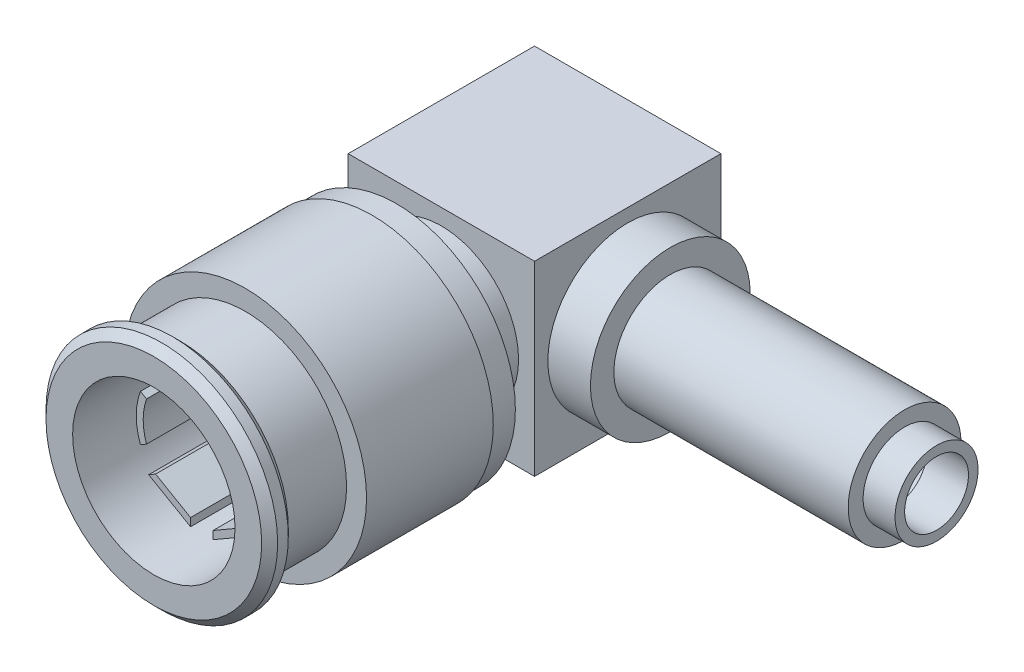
SolidWorks part; units mm, degrees
ref_plane "Front Plane" through (0, 0, 0) normal (0, 0, 1) x (1, 0, 0)
ref_plane "Top Plane" through (0, 0, 0) normal (0, 1, 0) x (1, 0, 0)
ref_plane "Right Plane" through (0, 0, 0) normal (1, 0, 0) x (0, 0, -1)
imported_body "Imported3"
sketch "Sketch1" plane through (0, 3.6802, 0) normal (0, 1, 0) x (-1, 0, 0)
  line L0 (-3.6716, -13.716) -> (3.683, -13.716)
  line L1 (3.683, -13.716) -> (3.683, -22.606)
  line L2 (3.683, -22.606) -> (-3.6716, -22.606)
  line L3 (-3.6716, -22.606) -> (-3.6716, -13.716)
extrude "Boss-Extrude1" add sketch "Sketch1" along normal blind 0.7648
sketch "Sketch2" plane through (3.6716, 0, 0) normal (1, 0, 0) x (0, 0, -1)
  line L0 (13.716, -3.683) -> (13.716, 4.445)
  line L1 (13.716, 4.445) -> (22.606, 4.445)
  line L2 (22.606, 4.445) -> (22.606, -3.683)
  line L3 (22.606, -3.683) -> (13.716, -3.683)
extrude "Boss-Extrude2" add sketch "Sketch2" along normal blind 0.7734
sketch "Sketch3" plane through (0, -3.683, 0) normal (0, -1, 0) x (1, 0, 0)
  line L0 (-3.683, -13.716) -> (4.445, -13.716)
  line L1 (4.445, -13.716) -> (4.445, -22.606)
  line L2 (4.445, -22.606) -> (-3.683, -22.606)
  line L3 (-3.683, -22.606) -> (-3.683, -13.716)
extrude "Boss-Extrude3" add sketch "Sketch3" along normal blind 0.762
sketch "Sketch4" plane through (-3.683, 0, 0) normal (-1, 0, 0) x (0, 0, 1)
  line L0 (-22.606, 4.445) -> (-13.716, 4.445)
  line L1 (-13.716, 4.445) -> (-13.716, -4.445)
  line L2 (-13.716, -4.445) -> (-22.606, -4.445)
  line L3 (-22.606, -4.445) -> (-22.606, 4.445)
extrude "Boss-Extrude4" add sketch "Sketch4" along normal blind 0.762
hole_wizard "M7 Clearance Hole1" positions "Sketch6" profile "Sketch5" hole size "M7" standard "ANSI Metric"
sketch "Sketch6" plane through (0, 0, 0) normal (0, 0, 1) x (1, 0, 0)
  point P0 (0, 0)
sketch "Sketch5" plane through (0, 0, 0) normal (1, 0, 0) x (0, -1, 0)
  line L0 (0, 0) -> (0, 6.1722)
  line L1 (0, 6.1722) -> (3.8735, 6.1722)
  line L2 (3.8735, 6.1722) -> (3.8735, 0)
  line L5 (3.8735, 0) -> (0, 0)
  line L10 (0, 6.1722) -> (-3.8735, 6.1722) construction
  line L11 (0, -6.35) -> (0, 107.95) construction
  dimension "Hole Dia." = 7.747
  dimension "Hole Depth" = 6.1722
  dimension "Drill Angle" = 180
sketch "Sketch7" plane through (0, 0, -6.1722) normal (0, 0, 1) x (1, 0, 0)
  line L0 (2.9236, -1.1014) -> (2.6333, -0.9338)
  line L1 (2.6333, 0.9338) -> (2.9236, 1.1014)
  arc A0 (2.6333, -0.9338) -> (2.6333, 0.9338) centre (0, 0) ccw
  arc A1 (2.9236, 1.1014) -> (2.9236, -1.1014) centre (0, 0) cw
extrude "Boss-Extrude5" add sketch "Sketch7" along normal blind 3.8862
sketch "Sketch8" plane through (0, 0, -6.1722) normal (0, 0, 1) x (1, 0, 0)
  line L0 (-2.6333, -0.9338) -> (-2.9236, -1.1014)
  line L1 (-2.9236, 1.1014) -> (-2.6333, 0.9338)
  arc A0 (-2.9236, -1.1014) -> (-2.9236, 1.1014) centre (0, 0) cw
  arc A1 (-2.6333, 0.9338) -> (-2.6333, -0.9338) centre (0, 0) ccw
extrude "Boss-Extrude6" add sketch "Sketch8" along normal blind 3.8862
sketch "Sketch9" plane through (0, 0, -6.1722) normal (0, 0, 1) x (1, 0, 0)
  line L0 (2.6333, 0.9338) -> (2.9236, 1.1014)
  line L1 (-2.9236, 1.1014) -> (-2.6333, 0.9338)
  line L2 (-2.6333, -0.9338) -> (-2.9236, -1.1014)
  line L3 (2.9236, -1.1014) -> (2.6333, -0.9338)
  arc A0 (2.6333, -0.9338) -> (2.6333, 0.9338) centre (0, 0) ccw
  arc A1 (2.9236, 1.1014) -> (-2.9236, 1.1014) centre (0, 0) ccw
  arc A2 (-2.6333, 0.9338) -> (-2.6333, -0.9338) centre (0, 0) ccw
  arc A3 (-2.9236, -1.1014) -> (2.9236, -1.1014) centre (0, 0) ccw
extrude "Cut-Extrude1" cut sketch "Sketch9" against normal blind 0.9398
sketch "Sketch10" plane through (0, 0, -7.112) normal (0, 0, 1) x (1, 0, 0)
  line L0 (2.9236, -1.1014) -> (2.6333, -0.9338)
  line L1 (-2.6333, -0.9338) -> (-2.9236, -1.1014)
  arc A0 (-2.9236, -1.1014) -> (2.9236, -1.1014) centre (0, 0) ccw
  arc A1 (2.6333, -0.9338) -> (-2.6333, -0.9338) centre (0, 0) cw
extrude "Cut-Extrude2" cut sketch "Sketch10" against normal blind 0.254
sketch "Sketch11" plane through (0, 0, -7.112) normal (0, 0, 1) x (1, 0, 0)
  line L0 (-2.9236, 1.1014) -> (-2.6333, 0.9338)
  line L1 (2.6333, 0.9338) -> (2.9236, 1.1014)
  arc A0 (-2.6333, 0.9338) -> (2.6333, 0.9338) centre (0, 0) cw
  arc A1 (2.9236, 1.1014) -> (-2.9236, 1.1014) centre (0, 0) ccw
extrude "Cut-Extrude3" cut sketch "Sketch11" against normal blind 0.254
sketch "Sketch12" plane through (4.445, 0, 0) normal (1, 0, 0) x (0, 0, -1)
  circle A0 centre (18.161, 0) radius 3.81
extrude "Boss-Extrude7" add sketch "Sketch12" along normal blind 2.032
sketch "Sketch13" plane through (6.477, 0, 0) normal (1, 0, 0) x (0, 0, -1)
  circle A0 centre (18.161, 0) radius 2.6924
extrude "Boss-Extrude8" add sketch "Sketch13" along normal blind 11.176
sketch "Sketch14" plane through (17.653, 0, 0) normal (1, 0, 0) x (0, 0, -1)
  circle A0 centre (18.161, 0) radius 1.9812
extrude "Boss-Extrude9" add sketch "Sketch14" along normal blind 1.524
ref_plane "Plane1" through (6.477, 0, 0) normal (-1, 0, 0) x (0, -1, 0)
sketch "Sketch15" plane through (6.477, 0, 0) normal (-1, 0, 0) x (0, -1, 0)
  circle A0 centre (0, -18.161) radius 2.2352
extrude "Cut-Extrude4" cut sketch "Sketch15" against normal blind 10.7188
ref_plane "Plane2" through (0, 0, -18.161) normal (0, 0, -1) x (-1, 0, 0)
sketch "Sketch16" plane through (0, 0, -18.161) normal (0, 0, -1) x (-1, 0, 0)
  line L0 (-19.177, 1.524) -> (-19.177, 0)
  line L1 (-19.177, 0) -> (-17.1958, 0)
  line L2 (-17.1958, 0) -> (-17.1958, 1.524)
  line L3 (-17.1958, 1.524) -> (-19.177, 1.524)
  line L4 (-19.177, 0) -> (-17.1958, 0) construction
revolve "Cut-Revolve1" cut sketch "Sketch16" angle 360 about L4
sketch "Sketch17" plane through (0, 0, 0) normal (0, 1, 0) x (1, 0, 0)
  line L0 (0.3289, 7.112) -> (0, 7.112)
  line L1 (0, 7.112) -> (0, 3.429)
  line L2 (0, 3.429) -> (0.127, 3.429)
  line L3 (0.127, 3.429) -> (0.3289, 3.7788)
  line L4 (0.3289, 3.7788) -> (0.3289, 7.112)
  line L5 (0, 7.112) -> (0, 3.429) construction
revolve "Revolve1" add sketch "Sketch17" angle 360 about L5
ref_plane "Plane3" through (0, 0, -18.161) normal (0, 0, 1) x (1, 0, 0)
sketch "Sketch18" plane through (0, 0, -18.161) normal (0, 0, 1) x (1, 0, 0)
  line L0 (6.477, 1.9431) -> (6.477, 0)
  line L1 (6.477, 0) -> (15.367, 0)
  line L2 (15.367, 0) -> (15.367, 1.9431)
  line L3 (15.367, 1.9431) -> (6.477, 1.9431)
  line L4 (6.477, 0) -> (15.367, 0) construction
revolve "Revolve2" add sketch "Sketch18" angle 360 about L4
hole_wizard "M1.6 Clearance Hole1" positions "Sketch20" profile "Sketch19" hole size "M1.6" standard "ANSI Metric"
sketch "Sketch20" plane through (15.367, 0, 0) normal (1, 0, 0) x (0, 0, -1)
  point P0 (18.161, 0)
sketch "Sketch19" plane through (15.367, 0, -18.161) normal (0, 1, 0) x (0, 0, -1)
  line L0 (0, 0) -> (0, 10.922)
  line L1 (0, 10.922) -> (0.8509, 10.922)
  line L2 (0.8509, 10.922) -> (0.8509, 0)
  line L5 (0.8509, 0) -> (0, 0)
  line L10 (0, 10.922) -> (-0.8509, 10.922) construction
  line L11 (0, -6.35) -> (0, 107.95) construction
  dimension "Hole Dia." = 1.7018
  dimension "Hole Depth" = 10.922
  dimension "Drill Angle" = 180
ref_plane "Plane4" through (0.0293, 0.0169, 0) normal (-0.866, -0.5, 0) x (0.5, -0.866, 0)
sketch "Sketch21" plane through (0.0293, 0.0169, 0) normal (-0.866, -0.5, 0) x (0.5, -0.866, 0)
  line L0 (-2.7938, -7.366) -> (-2.7938, -2.286)
  line L1 (-2.7938, -2.286) -> (-3.124, -2.286)
  line L2 (-3.124, -2.286) -> (-3.124, -7.366)
rib "Rib1" sketch "Sketch21" sketch "Sketch21" thickness 1.9456 extrusion direction parallel to sketch draft on yes draft angle 30 parameters "D1"=1.9456, "D3"=30
ref_plane "Plane5" through (-0.0293, -0.0169, 0) normal (-0.866, -0.5, 0) x (0.5, -0.866, 0)
sketch "Sketch22" plane through (-0.0293, -0.0169, 0) normal (-0.866, -0.5, 0) x (0.5, -0.866, 0)
  line L0 (3.124, -7.366) -> (3.124, -2.286)
  line L1 (3.124, -2.286) -> (2.7938, -2.286)
  line L2 (2.7938, -2.286) -> (2.7938, -7.366)
rib "Rib2" sketch "Sketch22" sketch "Sketch22" thickness 2.2891 extrusion direction parallel to sketch draft on yes draft angle 30 parameters "D1"=2.2891, "D3"=30
ref_plane "Plane6" through (0.0293, -0.0169, 0) normal (-0.866, 0.5, 0) x (-0.5, -0.866, 0)
sketch "Sketch23" plane through (0.0293, -0.0169, 0) normal (-0.866, 0.5, 0) x (-0.5, -0.866, 0)
  line L0 (3.124, -7.366) -> (3.124, -2.286)
  line L1 (3.124, -2.286) -> (2.7938, -2.286)
  line L2 (2.7938, -2.286) -> (2.7938, -7.366)
rib "Rib3" sketch "Sketch23" sketch "Sketch23" thickness 2.3056 extrusion direction parallel to sketch draft on yes draft angle 30 parameters "D1"=2.3056, "D3"=30
ref_plane "Plane7" through (-0.0293, 0.0169, 0) normal (-0.866, 0.5, 0) x (-0.5, -0.866, 0)
sketch "Sketch24" plane through (-0.0293, 0.0169, 0) normal (-0.866, 0.5, 0) x (-0.5, -0.866, 0)
  line L0 (-2.7938, -2.286) -> (-3.124, -2.286)
  line L1 (-3.124, -2.286) -> (-3.124, -7.366)
  line L2 (-2.7938, -7.366) -> (-2.7938, -2.286)
rib "Rib4" sketch "Sketch24" sketch "Sketch24" thickness 2.3056 extrusion direction parallel to sketch draft on yes draft angle 30 parameters "D1"=2.3056, "D3"=30
